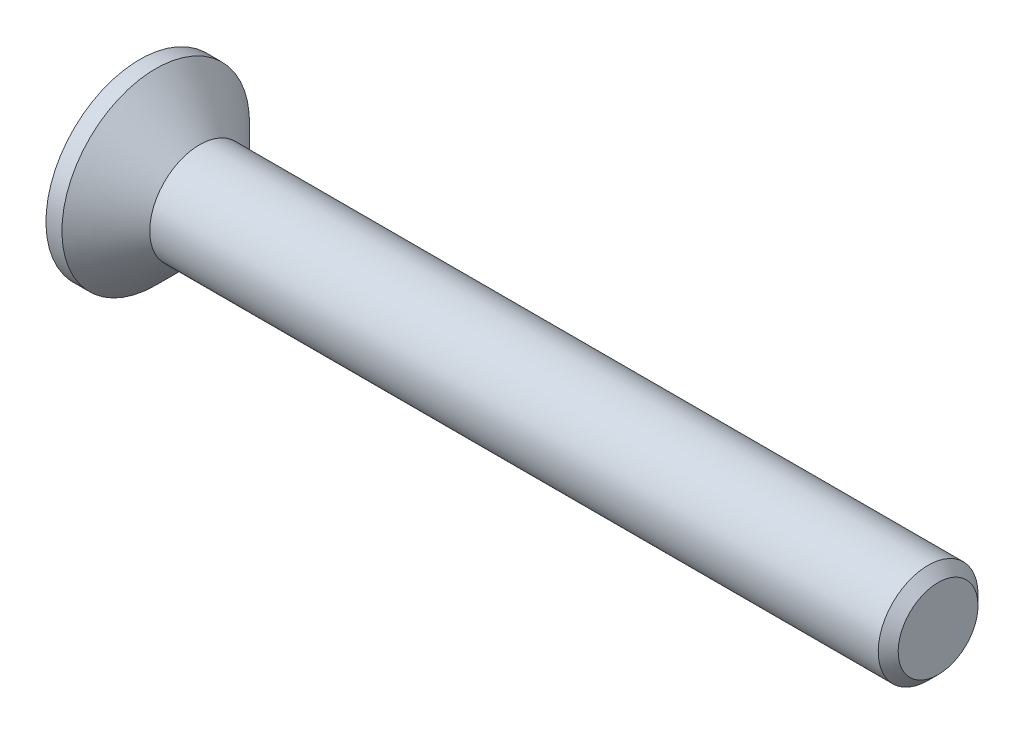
SolidWorks part; units mm, degrees
ref_plane "Front Plane" through (0, 0, 0) normal (0, 0, 1) x (1, 0, 0)
ref_plane "Top Plane" through (0, 0, 0) normal (0, 1, 0) x (1, 0, 0)
ref_plane "Right Plane" through (0, 0, 0) normal (1, 0, 0) x (0, 0, -1)
sketch "Sketch1" plane through (0, 0, 0) normal (0, 0, 1) x (1, 0, 0)
  line L1 (-1.5, 2.35) -> (-1.5, 0)
  line L2 (-1.5, 0) -> (18.5, 0)
  line L3 (18.5, 0) -> (18.5, 1.25)
  line L4 (18.5, 1.25) -> (0, 1.25)
  line L5 (-1.5, 2.35) -> (-1.1, 2.35)
  line L6 (-1.1, 2.35) -> (0, 1.25)
  dimension "D1" = 1.25
  dimension "D2" = 45
  dimension "D3" = 1.5
  dimension "D4" = 20
  dimension "D5" = 2.35
revolve "Revolve1" add sketch "Sketch1" angle 360 about L2
chamfer "Chamfer1" distance 0.25 angle 45 1 edges at (18.5, -1.25, 0)
sketch "Sketch2" plane through (-1.5, 0, 0) normal (-1, 0, 0) x (0, 0, 1)
  line L0 (-0.34, 1.35) -> (0.34, 1.35)
  line L1 (0.34, 1.35) -> (0.34, 0.34)
  line L2 (0.34, 0.34) -> (1.35, 0.34)
  line L3 (1.35, 0.34) -> (1.35, -0.34)
  line L4 (1.35, -0.34) -> (0.34, -0.34)
  line L5 (0.34, -0.34) -> (0.34, -1.35)
  line L6 (0.34, -1.35) -> (-0.34, -1.35)
  line L7 (-0.34, -1.35) -> (-0.34, -0.34)
  line L8 (-0.34, -0.34) -> (-1.35, -0.34)
  line L9 (-1.35, -0.34) -> (-1.35, 0.34)
  line L10 (-1.35, 0.34) -> (-0.34, 0.34)
  line L11 (-0.34, 0.34) -> (-0.34, 1.35)
  point P2 (0, 1.35)
  point P14 (0, -1.35)
  point P15 (1.35, 0)
  point P16 (-1.35, 0)
  dimension "D1" = 2.7
  dimension "D2" = 0.68
extrude "Cut-Extrude1" cut sketch "Sketch2" against normal blind 1.25
